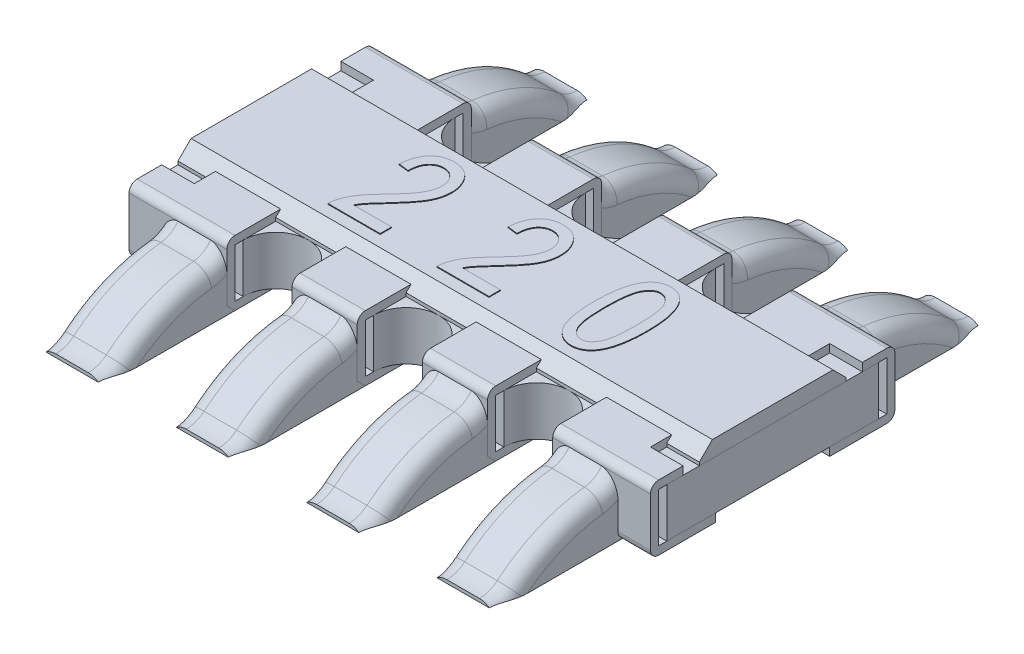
SolidWorks part; units mm, degrees
ref_plane "Front Plane" through (0, 0, 0) normal (0, 0, 1) x (1, 0, 0)
ref_plane "Top Plane" through (0, 0, 0) normal (0, 1, 0) x (1, 0, 0)
ref_plane "Right Plane" through (0, 0, 0) normal (1, 0, 0) x (0, 0, -1)
sketch "Sketch5" plane through (0, 0, 0) normal (1, 0, 0) x (0, 0, -1)
  line L0 (55, 0) -> (-55, 0) construction
  line L1 (-0.7, 0.4) -> (0.7, 0.4)
  line L2 (-0.75, 0.35) -> (-0.75, 0.05)
  line L3 (-0.7, 0) -> (-0.35, 0)
  line L4 (0.75, 0.35) -> (0.75, 0.05)
  line L5 (0, 55) -> (0, -55) construction
  line L8 (0.35, 0) -> (0.7, 0)
  arc A0 (0.7, 0.4) -> (0.75, 0.35) centre (0.7, 0.35) cw
  arc A1 (0.7, 0) -> (0.75, 0.05) centre (0.7, 0.05) ccw
  arc A2 (-0.75, 0.05) -> (-0.7, 0) centre (-0.7, 0.05) ccw
  arc A3 (-0.7, 0.4) -> (-0.75, 0.35) centre (-0.7, 0.35) ccw
  point P10 (0.75, 0.4)
  point P13 (0.75, 0)
  point P18 (-0.75, 0.4)
  dimension "D4" = 0.05
  dimension "D1" = 0.4
  dimension "D2" = 1.5
  dimension "D3" = 0.75
  dimension "D5" = 0.4
  dimension "D6" = 0.4
extrude "Extrude-Thin1" add sketch "Sketch5" along normal mid plane 3.2 thin
sketch "Sketch6" plane through (0, 0.4, 0) normal (0, 1, 0) x (1, 0, 0)
  line L1 (1.6, 0.75) -> (-1.6, 0.75) construction
  line L2 (-1, 0.75) -> (-0.6, 0.75)
  line L3 (-1, 0.75) -> (-1, 0.25)
  line L4 (-1, 0.25) -> (-0.6, 0.25)
  line L6 (-0.6, 0.75) -> (-0.6, 0.25)
  line L7 (0, -0.22) -> (0, 0.22) construction
  line L8 (-0.2, 0.75) -> (0.2, 0.75)
  line L9 (-0.2, 0.75) -> (-0.2, 0.25)
  line L10 (-0.2, 0.25) -> (0.2, 0.25)
  line L11 (0.2, 0.75) -> (0.2, 0.25)
  line L12 (0.6, 0.75) -> (1, 0.75)
  line L13 (0.6, 0.75) -> (0.6, 0.25)
  line L14 (0.6, 0.25) -> (1, 0.25)
  line L15 (1, 0.75) -> (1, 0.25)
  line L16 (1.6, 0.7) -> (1.6, -0.7) construction
  line L18 (1.6, -0.75) -> (-1.6, -0.75) construction
  line L19 (-1, -0.75) -> (-0.6, -0.75)
  line L20 (-1, -0.75) -> (-1, -0.25)
  line L21 (-1, -0.25) -> (-0.6, -0.25)
  line L22 (-0.6, -0.75) -> (-0.6, -0.25)
  line L24 (-0.2, -0.75) -> (0.2, -0.75)
  line L25 (-0.2, -0.75) -> (-0.2, -0.25)
  line L26 (-0.2, -0.25) -> (0.2, -0.25)
  line L27 (0.2, -0.75) -> (0.2, -0.25)
  line L28 (0.6, -0.75) -> (1, -0.75)
  line L29 (0.6, -0.75) -> (0.6, -0.25)
  line L30 (0.6, -0.25) -> (1, -0.25)
  line L31 (1, -0.75) -> (1, -0.25)
  dimension "D1" = 0.5
  dimension "D2" = 0.4
  dimension "D3" = 0.8
  dimension "D4" = 0.2
  dimension "D5" = 0.8
  dimension "D6" = 0.4
  dimension "D7" = 0.4
  dimension "D8" = 0.6
extrude "Cut-Extrude3" cut sketch "Sketch6" against normal through all
sketch "Sketch7" plane through (0, 0.4, 0) normal (0, 1, 0) x (1, 0, 0)
  line L0 (-1.6, 0.7) -> (-1.6, -0.7) construction
  line L1 (-1.6, -0.55) -> (-1.4, -0.55)
  line L2 (-1.6, -0.55) -> (-1.6, 0.55)
  line L3 (-1.6, 0.55) -> (-1.4, 0.55)
  line L4 (-1.4, -0.55) -> (-1.4, 0.55)
  line L5 (1.6, 0.7) -> (1.6, -0.7) construction
  line L6 (1.6, -0.55) -> (1.4, -0.55)
  line L7 (1.6, -0.55) -> (1.6, 0.55)
  line L8 (1.6, 0.55) -> (1.4, 0.55)
  line L9 (1.4, -0.55) -> (1.4, 0.55)
  line L12 (-0.22, 0) -> (0.22, 0) construction
  dimension "D1" = 0.55
  dimension "D2" = 1.1
  dimension "D3" = 0.2
extrude "Cut-Extrude4" cut sketch "Sketch7" against normal blind 0.1
sketch "Sketch1" plane through (0, 0.05, 0) normal (0, 1, 0) x (1, 0, 0)
  line L0 (-1.6, -0.65) -> (1.6, 0.65) construction
  line L1 (-1.6, 0.65) -> (1.6, 0.65)
  line L2 (-1.6, 0.65) -> (-1.6, -0.65)
  line L3 (-1.6, -0.65) -> (1.6, -0.65)
  line L4 (1.6, 0.65) -> (1.6, -0.65)
  line L5 (-1.2, 0.65) -> (-1.2, -0.65) construction
  line L6 (-1.6, 0.45) -> (1.6, 0.45) construction
  line L7 (-0.4, 0.65) -> (-0.4, -0.65) construction
  line L8 (-1.6, -0.45) -> (1.6, -0.45) construction
  line L9 (0.4, 0.65) -> (0.4, -0.65) construction
  line L10 (0, -0.22) -> (0, 0.22) construction
  line L11 (1.2, 0.65) -> (1.2, -0.65) construction
  dimension "D3" = 0.2
  dimension "D1" = 3.2
  dimension "D2" = 1.3
  dimension "D4" = 0.2
  dimension "D5" = 0.8
  dimension "D6" = 0.8
  dimension "D7" = 0.8
  dimension "D8" = 0.4
extrude "Boss-Extrude3" add sketch "Sketch1" along normal blind 0.3 separate body
sketch "Sketch9" plane through (0, 0.35, 0) normal (0, 1, 0) x (1, 0, 0)
  line L1 (-1.6, 0.45) -> (1.6, 0.45)
  line L2 (-1.6, 0.45) -> (-1.6, -0.45)
  line L3 (-1.6, -0.45) -> (1.6, -0.45)
  line L4 (1.6, 0.45) -> (1.6, -0.45)
extrude "Boss-Extrude4" add sketch "Sketch9" along normal blind 0.1
chamfer "Chamfer1" distance 0.08 angle 45 2 edges at (0, 0.45, 0.45) (0, 0.45, -0.45)
sketch "Sketch10" plane through (0, 0.05, 0) normal (0, 1, 0) x (1, 0, 0)
  line L0 (-1.6, 0.65) -> (1.6, 0.65) construction
  line L1 (-1.6, -0.65) -> (1.6, -0.65) construction
  line L2 (0, -0.2475) -> (0, 0.2475) construction
  circle A0 centre (-0.8, 0.65) radius 0.2
  circle A1 centre (0, 0.65) radius 0.2
  circle A2 centre (0.8, 0.65) radius 0.2
  circle A3 centre (0.8, -0.65) radius 0.2
  circle A4 centre (0, -0.65) radius 0.2
  circle A5 centre (-0.8, -0.65) radius 0.2
  dimension "D3" = 0.4
  dimension "D1" = 0.8
  dimension "D2" = 0.8
extrude "Cut-Extrude7" cut sketch "Sketch10" along normal blind 5
sketch "Sketch11" plane through (0, 0.45, 0) normal (0, 1, 0) x (1, 0, 0)
  line L0 (0, -0.2475) -> (0, 0.2475) construction
  line L2 (-0.2475, 0) -> (0.2475, 0) construction
  text T0 "2 2 0  " font "Arial Narrow" height 0.6
  dimension "D1" = 0.86
  dimension "D2" = 0.3
extrude "Boss-Extrude5" add sketch "Sketch11" along normal blind 0.005
ref_plane "Plane1" through (-1.2, 0, 0) normal (1, 0, 0) x (0, 0, -1)
sketch "Sketch12" plane through (-1.2, 0, 0) normal (1, 0, 0) x (0, 0, -1)
  line L0 (-0.75, 0.35) -> (-0.75, 0.05)
  line L1 (-0.75, 0.05) -> (-0.7, 0)
  line L2 (0.825, 0) -> (-0.825, 0) construction
  line L3 (-0.7, 0) -> (-1.5, 0)
  line L4 (-1.5, 0) -> (-1.5, 0.02)
  line L5 (0, 0.2475) -> (0, -0.2475) construction
  line L6 (0.75, 0.05) -> (0.7, 0)
  line L7 (0.7, 0) -> (1.5, 0)
  line L8 (1.5, 0) -> (1.5, 0.02)
  line L9 (0.75, 0.35) -> (0.75, 0.05)
  arc A0 (-0.75, 0.05) -> (-0.7, 0) centre (-0.7, 0.05) ccw construction
  arc A1 (-1.5, 0.02) -> (-1.3904, 0.06) centre (-1.5, 0.19) ccw
  arc A2 (-1.3904, 0.06) -> (-0.8548, 0.2894) centre (-0.746, -0.7047) cw
  arc A3 (-0.8548, 0.2894) -> (-0.75, 0.35) centre (-0.8711, 0.4385) ccw
  arc A4 (1.5, 0.02) -> (1.3904, 0.06) centre (1.5, 0.19) cw
  arc A5 (1.3904, 0.06) -> (0.8548, 0.2894) centre (0.746, -0.7047) ccw
  arc A6 (0.8548, 0.2894) -> (0.75, 0.35) centre (0.8711, 0.4385) cw
  dimension "D2" = 0.15
  dimension "D3" = 0.17
  dimension "D4" = 1
  dimension "D1" = 0.02
  dimension "D5" = 1.5
  dimension "D6" = 0.7047
  dimension "D7" = 1.5
extrude "Boss-Extrude6" add sketch "Sketch12" along normal mid plane 0.4 separate body
fillet "Fillet1" radius 0.1 6 edges at (-1.4, 0.3087, 0.796) (-1.4, 0.0303, 1.4417) (-1, 0.3087, 0.796) (-1, 0.0303, 1.4417) (-1.4, 0.2146, 1.1397) (-1, 0.2146, 1.1397)
fillet "Fillet2" radius 0.1 6 edges at (-1, 0.0303, -1.4417) (-1, 0.3087, -0.796) (-1.4, 0.0303, -1.4417) (-1.4, 0.3087, -0.796) (-1, 0.2146, -1.1397) (-1.4, 0.2146, -1.1397)
pattern_linear "LPattern3" count 4 spacing 0.8 along (1, 0, 0)
